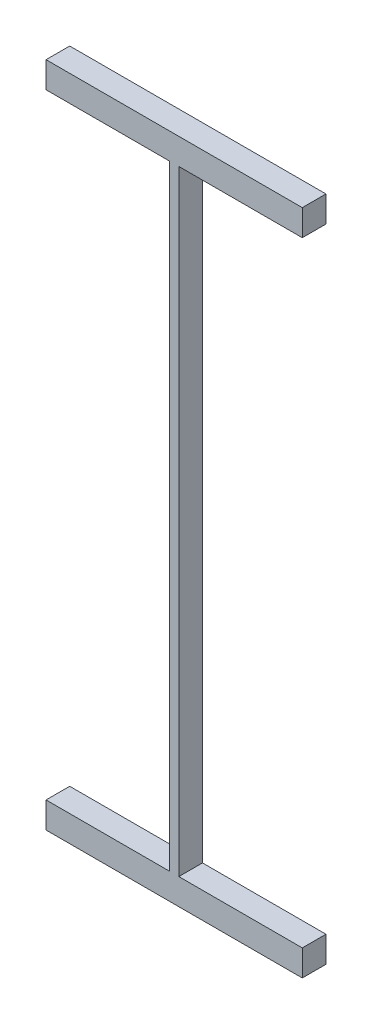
SolidWorks part; units mm, degrees
ref_plane "Front Plane" through (0, 0, 0) normal (0, 0, 1) x (1, 0, 0)
ref_plane "Top Plane" through (0, 0, 0) normal (0, 1, 0) x (1, 0, 0)
ref_plane "Right Plane" through (0, 0, 0) normal (1, 0, 0) x (0, 0, -1)
other "Configuration Table"
sketch "Sketch1" plane through (0, 0, 0) normal (0, 0, 1) x (1, 0, 0)
  line L0 (-137.5, -330) -> (-137.5, -358)
  line L1 (-137.5, 358) -> (137.5, 358)
  line L2 (-137.5, 358) -> (-137.5, 330)
  line L3 (-137.5, -358) -> (137.5, -358)
  line L4 (0, 358) -> (0, -358) construction
  line L5 (-137.5, 330) -> (-5, 330)
  line L6 (137.5, -330) -> (137.5, -358)
  line L7 (-137.5, -330) -> (-5, -330)
  line L8 (-5, 330) -> (-5, -330)
  line L9 (137.5, -330) -> (5, -330)
  line L10 (5, 330) -> (5, -330)
  line L11 (137.5, 330) -> (5, 330)
  line L12 (137.5, 358) -> (137.5, 330)
  dimension "Width" = 275
  dimension "Depth" = 716
  dimension "Web_thickness" = 10
  dimension "Thickness" = 28
extrude "BaseSection" add sketch "Sketch1" along normal mid plane 25.4
